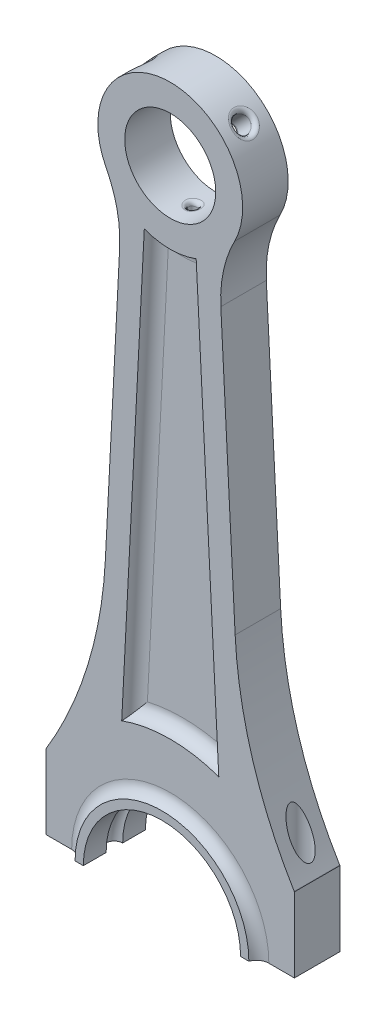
SolidWorks part; units mm, degrees
ref_plane "Front Plane" through (0, 0, 0) normal (0, 0, 1) x (1, 0, 0)
ref_plane "Top Plane" through (0, 0, 0) normal (0, 1, 0) x (1, 0, 0)
ref_plane "Right Plane" through (0, 0, 0) normal (1, 0, 0) x (0, 0, -1)
sketch "Sketch1" plane through (0, 0, 0) normal (0, 0, 1) x (1, 0, 0)
  line L0 (-12.2232, 97.794) -> (-15.6844, 30.8239)
  line L1 (12.2232, 97.794) -> (15.6844, 30.8239)
  line L2 (0, 121.1787) -> (0, 1.1787) construction
  line L3 (-30, -15.7936) -> (-30, -33.8213)
  line L4 (30, -15.7936) -> (30, -33.8213)
  line L6 (0, -14.8213) -> (0, -33.8213) construction
  line L7 (0, 1.1787) -> (0, -14.8213) construction
  line L8 (-30, -33.8213) -> (-19, -33.8213)
  line L9 (19, -33.8213) -> (30, -33.8213)
  circle A0 centre (0, 121.1787) radius 11
  arc A1 (19, -33.8213) -> (-19, -33.8213) centre (0, -33.8213) ccw
  arc A2 (15.5412, 113.1337) -> (-15.5412, 113.1337) centre (0, 121.1787) ccw
  arc A3 (30, -15.7936) -> (29.9577, -15.7233) centre (0, -33.8213) ccw
  arc A4 (-29.9577, -15.7233) -> (-30, -15.7936) centre (0, -33.8213) ccw
  arc A5 (-15.6844, 30.8239) -> (-29.9577, -15.7233) centre (-115.5511, 35.9852) cw
  arc A6 (15.6844, 30.8239) -> (29.9577, -15.7233) centre (115.5511, 35.9852) ccw
  arc A7 (15.5412, 113.1337) -> (12.2232, 97.794) centre (42.1833, 99.3424) ccw
  arc A8 (-15.5412, 113.1337) -> (-12.2232, 97.794) centre (-42.1833, 99.3424) cw
  point P20 (-17.4576, -3.486)
  dimension "D2" = 22
  dimension "D3" = 38
  dimension "D4" = 35
  dimension "D5" = 70
  dimension "D7" = 100
  dimension "D8" = 30
  dimension "D1" = 155
  dimension "D6" = 30
extrude "Boss-Extrude1" add sketch "Sketch1" along normal mid plane 11
sketch "Sketch2" plane through (0, 0, 5.5) normal (0, 0, 1) x (1, 0, 0)
  line L0 (6.2686, 104.8399) -> (11.7306, -0.8457)
  line L2 (0, 103.6787) -> (0, 1.1787) construction
  line L3 (15.6844, 30.8239) -> (12.2232, 97.794) construction
  line L4 (-6.2686, 104.8399) -> (-11.7306, -0.8457)
  arc A0 (11.7306, -0.8457) -> (-11.7306, -0.8457) centre (0, -33.8213) ccw
  arc A1 (-6.2686, 104.8399) -> (6.2686, 104.8399) centre (0, 121.1787) ccw
extrude "Cut-Extrude1" cut sketch "Sketch2" against normal blind 3
sketch "Sketch3" plane through (0, -33.8213, 0) normal (0, -1, 0) x (1, 0, 0)
  line L1 (-30, 5.5) -> (-19, 5.5) construction
  line L2 (19, 5.5) -> (30, 5.5) construction
  circle A0 centre (-26, 0) radius 2.5
  circle A1 centre (26, 0) radius 2.5
  dimension "D3" = 5
  dimension "D4" = 5
  dimension "D5" = 5.5
  dimension "D1" = 26
  dimension "D2" = 26
  dimension "D6" = 5.5
extrude "Cut-Extrude2" cut sketch "Sketch3" against normal blind 65
sketch "Sketch4" plane through (0, -33.8213, 0) normal (0, -1, 0) x (1, 0, 0)
  circle A0 centre (-26, 0) radius 3.5
  circle A1 centre (26, 0) radius 3.5
extrude "Cut-Extrude3" cut sketch "Sketch4" against normal blind 1
sketch "Sketch5" plane through (0, 0, 5.5) normal (0, 0, 1) x (1, 0, 0)
  line L0 (-30, -33.8213) -> (-19, -33.8213) construction
  line L1 (19, -33.8213) -> (30, -33.8213) construction
  line L2 (-21, -33.8213) -> (-19, -33.8213)
  line L3 (19, -33.8213) -> (21, -33.8213)
  arc A0 (-21, -33.8213) -> (21, -33.8213) centre (0, -33.8213) cw
  arc A1 (19, -33.8213) -> (-19, -33.8213) centre (0, -33.8213) ccw construction
  arc A2 (19, -33.8213) -> (-19, -33.8213) centre (0, -33.8213) ccw
  dimension "D1" = 21
extrude "Boss-Extrude2" add sketch "Sketch5" along normal blind 2
fillet "Fillet1" radius 3 5 edges at (0, 1.1787, 2.5) (8.9996, 51.9971, 2.5) (0, 103.6787, 2.5) (-8.9996, 51.9971, 2.5)
mirror "Mirror4" about plane through (0, 0, 0) normal (0, 0, 1) of "Cut-Extrude1", "Boss-Extrude2"
fillet "Fillet2" radius 3 5 edges at (8.9996, 51.9971, -2.5) (0, 103.6787, -2.5) (-8.9996, 51.9971, -2.5) (0, 1.1787, -2.5)
sketch "Sketch7" plane through (0, -33.8213, 0) normal (0, -1, 0) x (1, 0, 0)
  line L0 (0, 0) -> (0, 16.9516) construction
  line L1 (-19, 7.5) -> (-19, -7.5) construction
  circle A0 centre (-19, 0) radius 2
revolve "Cut-Revolve1" cut sketch "Sketch7" angle 360 about L0
sketch "Sketch8" plane through (0, -33.8213, 0) normal (0, -1, 0) x (1, 0, 0)
  circle A0 centre (0, 0) radius 1
  dimension "D1" = 2
extrude "Cut-Extrude4" cut sketch "Sketch8" against normal blind 148
sketch "Sketch9" plane through (0, 0, 0) normal (0, 0, 1) x (1, 0, 0)
  line L0 (-18.3061, 139.4848) -> (-5.4754, 126.6541)
  line L2 (-18.3061, 139.4848) -> (-16.8919, 140.899)
  line L3 (-16.8919, 140.899) -> (-4.0612, 128.0683)
  line L4 (-4.0612, 128.0683) -> (-5.4754, 126.6541)
  point P0 (0, 121.1787)
revolve "Cut-Revolve2" cut sketch "Sketch9" angle 360 about L0
mirror "Mirror5" about plane through (0, 0, 0) normal (1, 0, 0) of "Cut-Revolve2"
fillet "Fillet3" radius 1 6 edges at (0.6149, -12.9924, 0.7886) (0.2254, 110.181, 0.9743) (10.9186, 134.8547, 0.4454) (6.2722, 130.2152, 0.4233) (-10.9186, 134.8547, -0.4454) (-6.2722, 130.2152, -0.4233)
